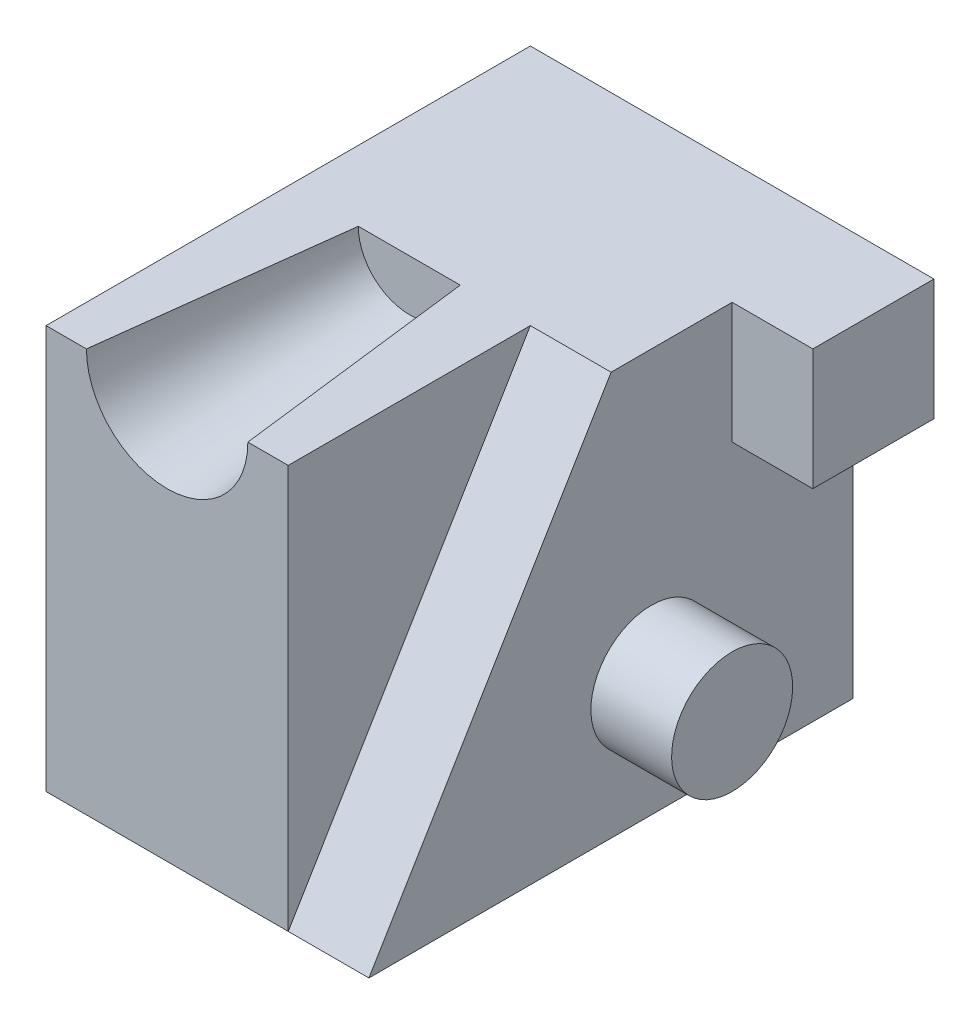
SolidWorks part; units mm, degrees
ref_plane "Front Plane" through (0, 0, 0) normal (0, 0, 1) x (1, 0, 0)
ref_plane "Top Plane" through (0, 0, 0) normal (0, 1, 0) x (1, 0, 0)
ref_plane "Right Plane" through (0, 0, 0) normal (1, 0, 0) x (0, 0, -1)
sketch "Sketch1" plane through (0, 0, 0) normal (0, 0, 1) x (1, 0, 0)
  line L1 (0, 0) -> (50, 0)
  line L2 (0, 0) -> (0, 50)
  line L3 (0, 50) -> (50, 50)
  line L4 (50, 0) -> (50, 50)
  dimension "D1" = 50
  dimension "D2" = 50
extrude "Extrude1" add sketch "Sketch1" along normal mid plane 60
sketch "Sketch2" plane through (50, 0, 0) normal (1, 0, 0) x (0, 0, -1)
  line L0 (-30, 50) -> (0, 50)
  line L11 (-30, 50) -> (30, 50) construction
  line L13 (0, 50) -> (-30, 0)
  line L14 (-30, 0) -> (-30, 50)
extrude "Cut-Extrude1" cut sketch "Sketch2" against normal blind 20
sketch "Sketch3" plane through (0, 0, 30) normal (0, 0, 1) x (1, 0, 0)
  line L0 (30, 50) -> (0, 50) construction
  circle A0 centre (15, 50) radius 10
  dimension "D1" = 20
extrude "Cut-Extrude2" cut sketch "Sketch3" against normal up to vertex (30 mm away) draft 7
sketch "Sketch4" plane through (50, 0, 0) normal (1, 0, 0) x (0, 0, -1)
  line L0 (30, 0) -> (30, 50) construction
  line L1 (-30, 0) -> (30, 0) construction
  line L3 (30, 50) -> (15, 50)
  line L4 (30, 50) -> (30, 35)
  line L5 (30, 35) -> (15, 35)
  line L6 (15, 50) -> (15, 35)
  circle A0 centre (5, 15) radius 7.5
  dimension "D1" = 15
  dimension "D2" = 25
  dimension "D3" = 15
  dimension "D4" = 15
  dimension "D5" = 15
extrude "Cut-Extrude3" cut sketch "Sketch4" against normal blind 10 flip side to cut
